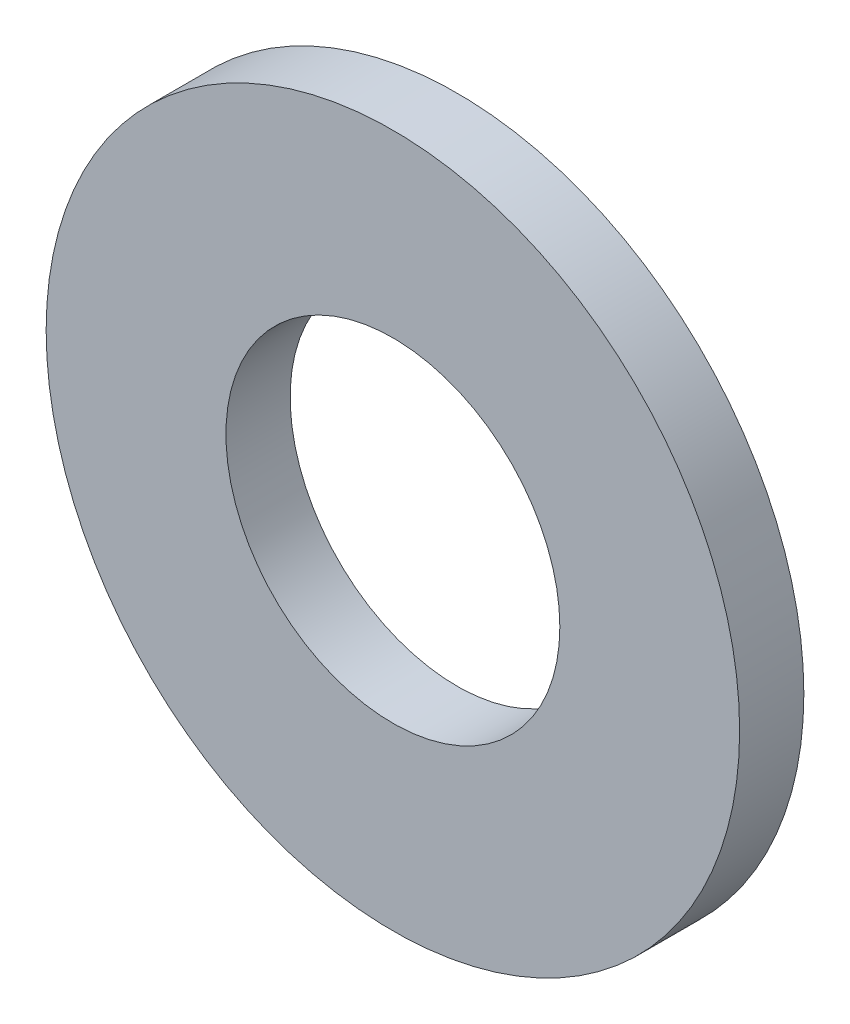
SolidWorks part; units mm, degrees
ref_plane "Plan de face" through (0, 0, 0) normal (0, 0, 1) x (1, 0, 0)
ref_plane "Plan de dessus" through (0, 0, 0) normal (0, 1, 0) x (1, 0, 0)
ref_plane "Plan de droite" through (0, 0, 0) normal (1, 0, 0) x (0, 0, -1)
sketch "Esquisse1" plane through (0, 0, 0) normal (0, 0, 1) x (1, 0, 0)
  circle A2 centre (67, 70) radius 6.5
  circle A3 centre (67, 70) radius 6.5
  circle A4 centre (67, 70) radius 13.5
  dimension "D2" = 27
  dimension "D1" = 0.5
extrude "Extrusion1" add sketch "Esquisse1" along normal blind 2.5
